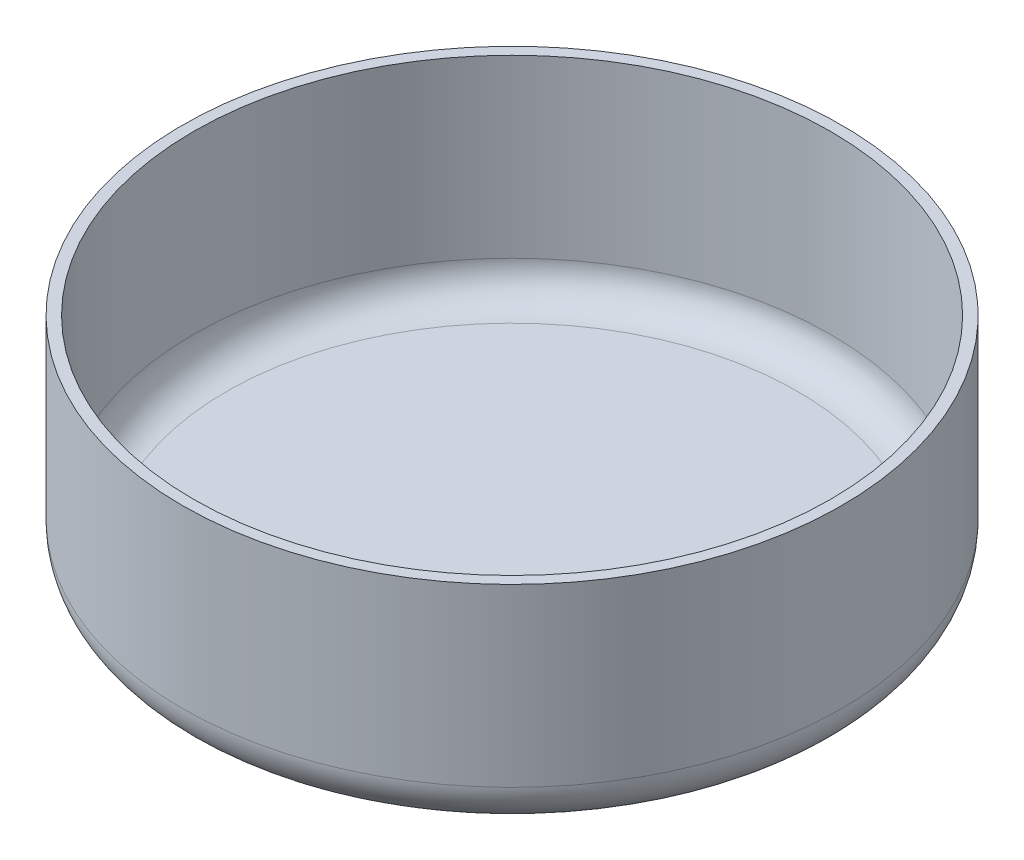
SolidWorks part; units mm, degrees
ref_plane "Front Plane" through (0, 0, 0) normal (0, 0, 1) x (1, 0, 0)
ref_plane "Top Plane" through (0, 0, 0) normal (0, 1, 0) x (1, 0, 0)
ref_plane "Right Plane" through (0, 0, 0) normal (1, 0, 0) x (0, 0, -1)
sketch "Sketch2" plane through (0, 0, 0) normal (0, 0, 1) x (1, 0, 0)
  line L0 (0, 0) -> (130, 0)
  line L1 (150, 20) -> (150, 100)
  line L2 (0, 5) -> (130, 5)
  line L3 (145, 20) -> (145, 100)
  line L4 (150, 100) -> (145, 100)
  line L5 (0, 0) -> (0, 5)
  line L7 (0, 80.4367) -> (0, 5) construction
  arc A0 (150, 20) -> (130, 0) centre (130, 20) cw
  arc A1 (145, 20) -> (130, 5) centre (130, 20) cw
  point P6 (150, 0)
  dimension "D3" = 20
  dimension "D1" = 150
  dimension "D2" = 100
  dimension "D4" = 5
revolve "Revolve1" add sketch "Sketch2" angle 360 about L7
